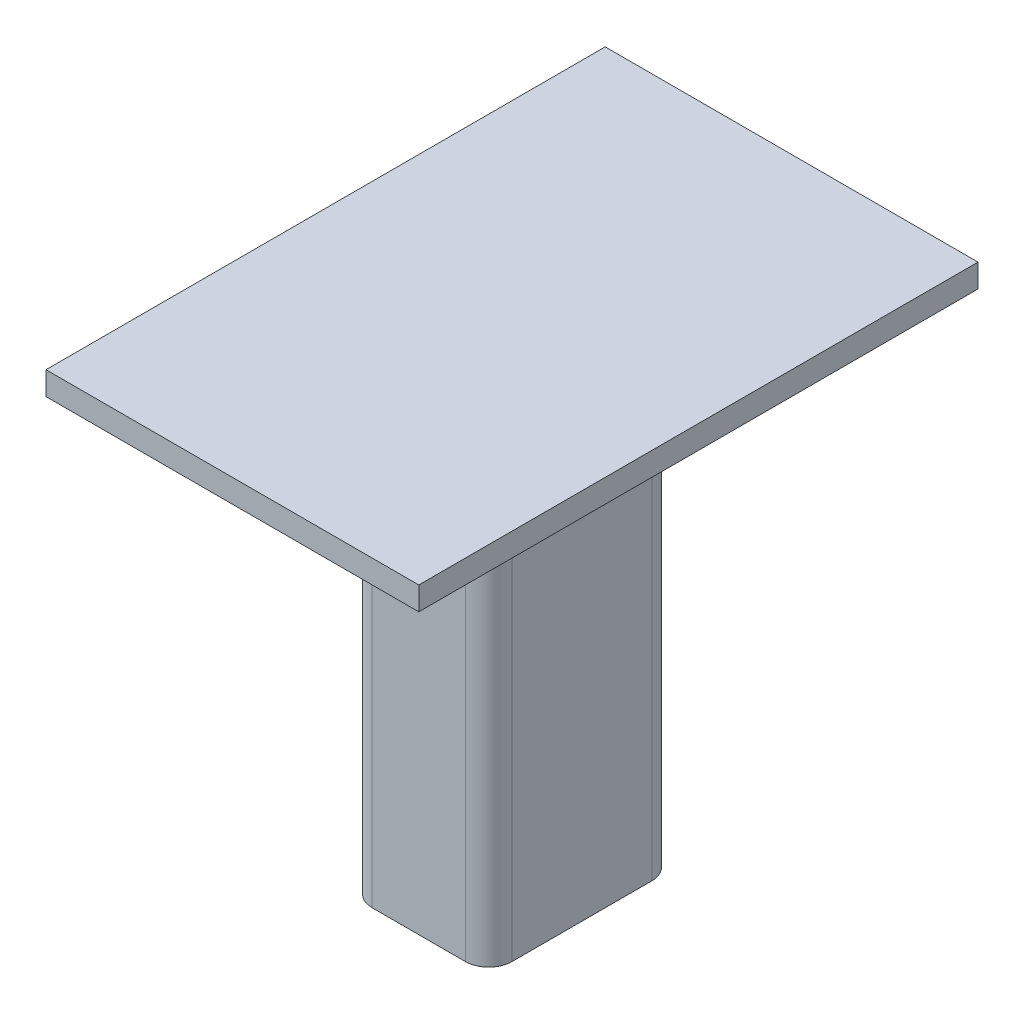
SolidWorks part; units mm, degrees
ref_plane "Front Plane" through (0, 0, 0) normal (0, 0, 1) x (1, 0, 0)
ref_plane "Top Plane" through (0, 0, 0) normal (0, 1, 0) x (1, 0, 0)
ref_plane "Right Plane" through (0, 0, 0) normal (1, 0, 0) x (0, 0, -1)
sketch "Sketch1" plane through (0, 0, 0) normal (0, 0, 1) x (1, 0, 0)
  line L0 (0, 0) -> (0, 254)
  dimension "D1" = 254
other "Structural Member1"
ref_plane "Plane1" through (0, 0, 0) normal (0, 1, 0) x (-1, 0, 0)
sketch "Sketch11" plane through (0, 0, 0) normal (0, 1, 0) x (-1, 0, 0)
  line L0 (-25.4, -44.45) -> (25.4, -44.45)
  line L1 (-31.75, -38.1) -> (-31.75, 38.1)
  line L2 (25.4, 44.45) -> (-25.4, 44.45)
  line L3 (31.75, 38.1) -> (31.75, -38.1)
  line L4 (-25.4, -50.8) -> (25.4, -50.8)
  line L5 (-38.1, -38.1) -> (-38.1, 38.1)
  line L6 (25.4, 50.8) -> (-25.4, 50.8)
  line L7 (38.1, 38.1) -> (38.1, -38.1)
  line L8 (0, 0) -> (38.1, 0) construction
  line L9 (0, 0) -> (0, 50.8) construction
  arc A0 (38.1, 38.1) -> (25.4, 50.8) centre (25.4, 38.1) ccw
  arc A1 (25.4, -50.8) -> (38.1, -38.1) centre (25.4, -38.1) ccw
  arc A2 (-38.1, -38.1) -> (-25.4, -50.8) centre (-25.4, -38.1) ccw
  arc A3 (-25.4, 50.8) -> (-38.1, 38.1) centre (-25.4, 38.1) ccw
  arc A4 (-25.4, 44.45) -> (-31.75, 38.1) centre (-25.4, 38.1) ccw
  arc A5 (31.75, 38.1) -> (25.4, 44.45) centre (25.4, 38.1) ccw
  arc A6 (25.4, -44.45) -> (31.75, -38.1) centre (25.4, -38.1) ccw
  arc A7 (-31.75, -38.1) -> (-25.4, -44.45) centre (-25.4, -38.1) ccw
  point P3 (0, -50.8)
  point P4 (-38.1, 0)
  point P5 (0, 0)
  point P6 (38.1, -50.8)
  point P7 (-38.1, -50.8)
  point P8 (-38.1, 50.8)
  point P33 (0, 0)
  point P35 (38.1, 50.8)
  point P36 (38.1, 0)
  point P37 (0, 50.8)
  dimension "D1" = 12.7
  dimension "Thickness" = 6.35
  dimension "V_leg" = 101.6
  dimension "H_leg" = 76.2
sketch "Sketch12" plane through (0, 254, 0) normal (0, 1, 0) x (1, 0, 0)
  line L1 (-101.6, 152.4) -> (101.6, 152.4)
  line L2 (-101.6, 152.4) -> (-101.6, -152.4)
  line L3 (-101.6, -152.4) -> (101.6, -152.4)
  line L4 (101.6, 152.4) -> (101.6, -152.4)
  line L5 (-101.6, 152.4) -> (101.6, -152.4) construction
  line L6 (-101.6, -152.4) -> (101.6, 152.4) construction
  point P0 (0, 0)
  dimension "D1" = 304.8
  dimension "D2" = 203.2
extrude "Boss-Extrude1" add sketch "Sketch12" along normal blind 12.7 separate body
